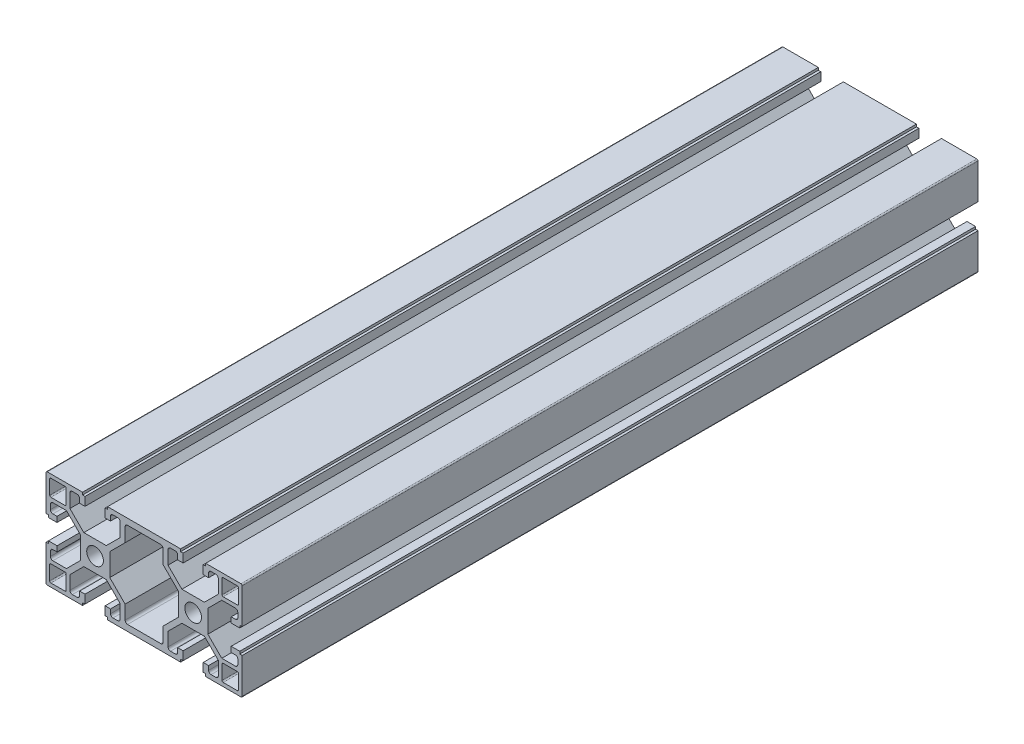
SolidWorks part; units mm, degrees
ref_plane "前视基准面" through (0, 0, 0) normal (0, 0, 1) x (1, 0, 0)
ref_plane "上视基准面" through (0, 0, 0) normal (0, 1, 0) x (1, 0, 0)
ref_plane "右视基准面" through (0, 0, 0) normal (1, 0, 0) x (0, 0, -1)
sketch "草图1"
sketch_block_instance "A$C1D7D2A6E-1"
sketch_block "A$C1D7D2A6E"
extrude "凸台-拉伸1" add sketch "草图1" along normal mid plane 300
